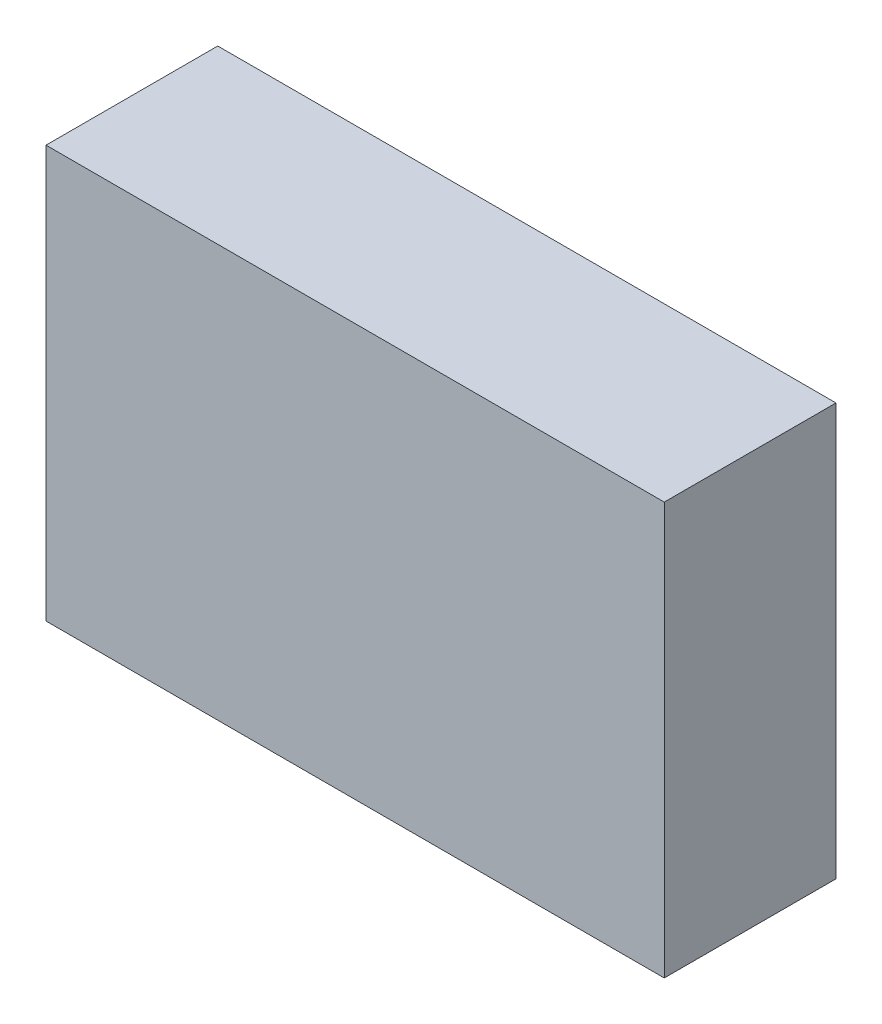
SolidWorks part; units mm, degrees
ref_plane "Face" through (0, 0, 0) normal (0, 0, 1) x (1, 0, 0)
ref_plane "Dessus" through (0, 0, 0) normal (0, 1, 0) x (1, 0, 0)
ref_plane "Droite" through (0, 0, 0) normal (1, 0, 0) x (0, 0, -1)
sketch "Esquisse2" plane through (0, 0, 0) normal (0, 0, 1) x (1, 0, 0)
  line L1 (-423.0566, 577.3734) -> (-333.0566, 577.3734)
  line L2 (-423.0566, 577.3734) -> (-423.0566, 517.3734)
  line L3 (-423.0566, 517.3734) -> (-333.0566, 517.3734)
  line L4 (-333.0566, 577.3734) -> (-333.0566, 517.3734)
  dimension "D1" = 60
  dimension "D2" = 90
  dimension "D3" = 517.3734
  dimension "D4" = 333.0566
extrude "Base-Extrusion" add sketch "Esquisse2" along normal blind 25
